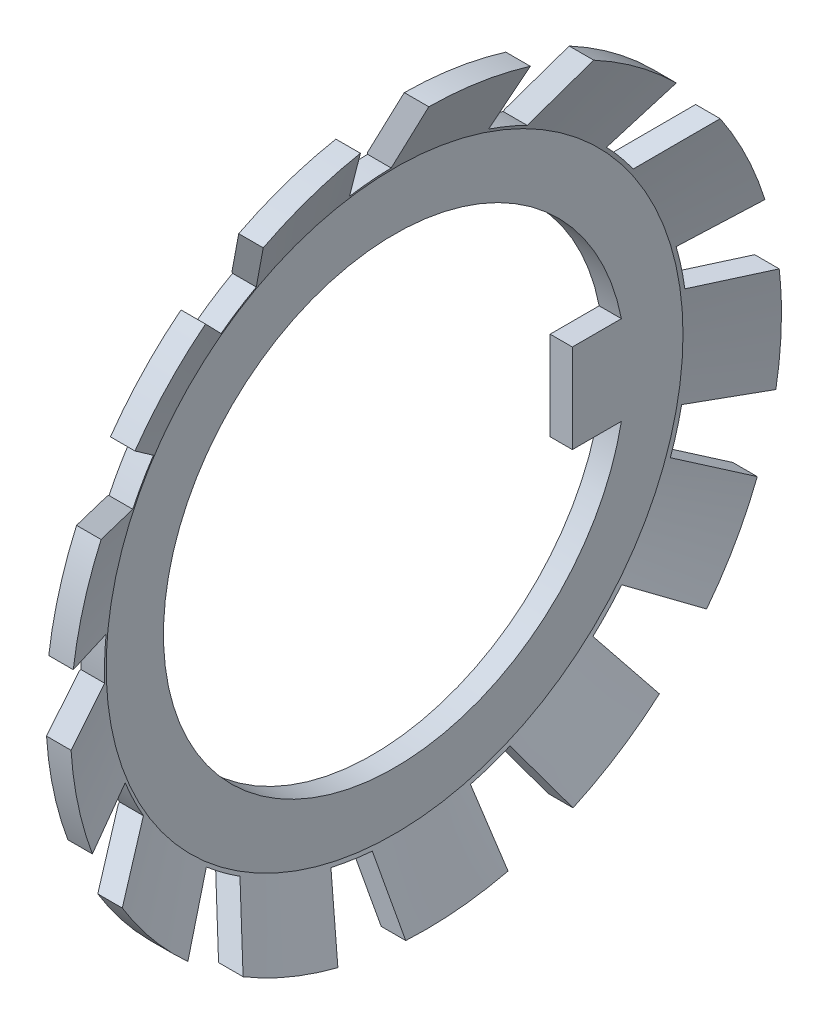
SolidWorks part; units mm, degrees
ref_plane "Plan1" through (0, 0, 0) normal (0, 0, 1) x (1, 0, 0)
ref_plane "Plan2" through (0, 0, 0) normal (0, 1, 0) x (1, 0, 0)
ref_plane "Plan3" through (0, 0, 0) normal (1, 0, 0) x (0, 0, -1)
sketch "Esquisse1" plane through (0, 0, 0) normal (0, 0, 1) x (1, 0, 0)
  line L0 (0, 0) -> (0, 16.5)
  line L1 (0, 16.5) -> (1.6321, 20)
  line L2 (1.6321, 20) -> (3.0113, 20)
  line L3 (3.0113, 20) -> (1.25, 16.2229)
  line L4 (1.25, 16.2229) -> (1.25, 0)
  line L5 (1.25, 0) -> (0, 0)
  line L6 (0, 16.5) -> (0, 30) construction
  line L7 (0, 0) -> (-60, 0) construction
  dimension "D1" = 16.5
  dimension "D2" = 20
  dimension "D3" = 1.25
  dimension "D4" = 1.25
  dimension "D5" = 25
revolve "Base-Révolution" add sketch "Esquisse1" angle 360 about L7
sketch "Esquisse2" plane through (0, 0, 0) normal (-1, 0, 0) x (0, 0, 1)
  circle A0 centre (0, 0) radius 13
  dimension "D1" = 26
extrude "Enlèv. mat.-Extru.1" cut sketch "Esquisse2" against normal through all
sketch "Esquisse4" plane through (0, 0, 0) normal (-1, 0, 0) x (0, 0, 1)
  line L0 (-14, -2.5) -> (-10, -2.5)
  line L1 (-14, -2.5) -> (-14, 2.5)
  line L2 (-10, 2.5) -> (-14, 2.5)
  line L3 (-10, 2.5) -> (-10, -2.5)
  dimension "D1" = 5
  dimension "D2" = 4
  dimension "D3" = 2.5
  dimension "D4" = 10
extrude "Boss.-Extru.1" add sketch "Esquisse4" against normal blind 1.25
sketch "Esquisse6" plane through (0, 0, 0) normal (-1, 0, 0) x (0, 0, 1)
  line L0 (-16.2449, 2.25) -> (-21.2814, 2.25)
  line L1 (0, 0) -> (0, -25) construction
  line L2 (0, 0) -> (-47.0529, 10.0014) construction
  line L3 (0, 0) -> (-54, 0) construction
  line L4 (-15.7556, 4.5519) -> (-20.3567, 6.6004)
  arc A0 (-20.3567, 6.6004) -> (-21.2814, 2.25) centre (0, 0) ccw
  arc A1 (-15.7556, 4.5519) -> (-16.2449, 2.25) centre (0, 0) ccw
  dimension "D1" = 12
  dimension "D2" = 2.25
  dimension "D3" = 32.8
  dimension "D4" = 42.8
extrude "Enlèv. mat.-Extru.6" cut sketch "Esquisse6" against normal through all
pattern_circular "Répétition circulaire3" count 13 every 27.69
